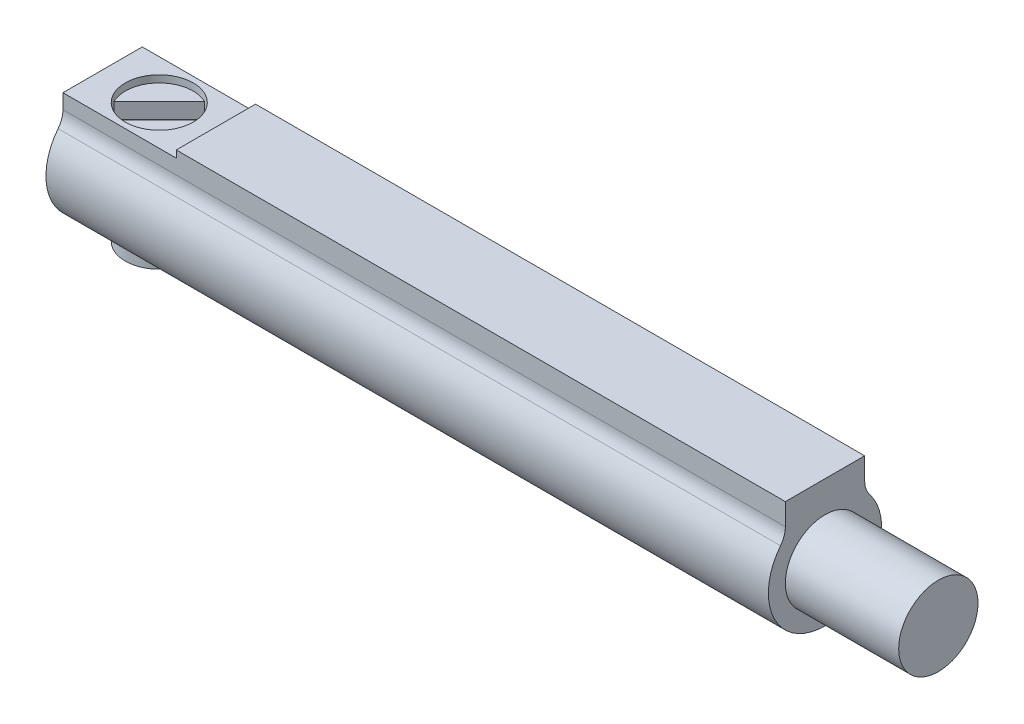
SolidWorks part; units mm, degrees
ref_plane "Front Plane" through (0, 0, 0) normal (0, 0, 1) x (1, 0, 0)
ref_plane "Top Plane" through (0, 0, 0) normal (0, 1, 0) x (1, 0, 0)
ref_plane "Right Plane" through (0, 0, 0) normal (1, 0, 0) x (0, 0, -1)
sketch "Sketch1" plane through (0, 0, 0) normal (1, 0, 0) x (0, 0, -1)
  line L0 (1.4, 1.7321) -> (1.4, 2.25)
  line L1 (1.4, 2.25) -> (-1.4, 2.25)
  line L2 (-1.4, 2.25) -> (-1.4, 1.7321)
  arc A0 (-1.5714, 1.2372) -> (1.5714, 1.2372) centre (0, 0) ccw
  arc A1 (1.5714, 1.2372) -> (1.4, 1.7321) centre (2.2, 1.7321) cw
  arc A2 (-1.4, 1.7321) -> (-1.5714, 1.2372) centre (-2.2, 1.7321) cw
extrude "Extrude1" add sketch "Sketch1" along normal blind 25.5
ref_plane "Plane1" through (4, 0, 0) normal (1, 0, 0) x (0, 0, -1)
sketch "Sketch2" plane through (4, 0, 0) normal (1, 0, 0) x (0, 0, -1)
  line L0 (-1.4, 2.5) -> (-1.4, 0.5)
  line L1 (-1.4, 0.5) -> (1.4, 0.5)
  line L2 (1.4, 0.5) -> (1.4, 2.5)
  line L3 (1.4, 2.5) -> (-1.4, 2.5)
ref_plane "Plane2" through (25.5, 0, 0) normal (1, 0, 0) x (0, 0, -1)
sketch "Sketch3" plane through (25.5, 0, 0) normal (1, 0, 0) x (0, 0, -1)
  circle A0 centre (0, 0) radius 1.4
extrude "Extrude2" add sketch "Sketch3" along normal blind 4
extrude "Extrude3" add sketch "Sketch2" along normal blind 21.5
ref_plane "Plane3" through (0, 2.25, 0) normal (0, 1, 0) x (-1, 0, 0)
sketch "Sketch4" plane through (0, 2.25, 0) normal (0, 1, 0) x (-1, 0, 0)
  circle A0 centre (-2, 0) radius 1.2
extrude "Cut-Extrude1" cut sketch "Sketch4" against normal blind 4.5
sketch "Sketch5" plane through (0, 0, 0) normal (0, 0, 1) x (1, 0, 0)
  line L0 (2, 2) -> (3.2, 2)
  line L1 (3.2, 2) -> (3.2, -2)
  line L2 (3.2, -2) -> (2, -2)
  line L3 (2, -2) -> (2, 2)
  line L4 (2, -2) -> (2, 2) construction
revolve "Revolve1" add sketch "Sketch5" angle 360 about L4
sketch "Sketch6" plane through (0, 2.25, 0) normal (0, 1, 0) x (-1, 0, 0)
  line L0 (-1.4828, 1.0828) -> (-3.0828, -0.5172)
  line L1 (-2.5172, -1.0828) -> (-0.9172, 0.5172)
  arc A0 (-0.9172, 0.5172) -> (-1.4828, 1.0828) centre (-2, 0) ccw
  arc A1 (-3.0828, -0.5172) -> (-2.5172, -1.0828) centre (-2, 0) ccw
extrude "Cut-Extrude2" cut sketch "Sketch6" against normal blind 0.8
ref_plane "Plane4" through (12.75, 0, 0) normal (1, 0, 0) x (0, 0, -1)
